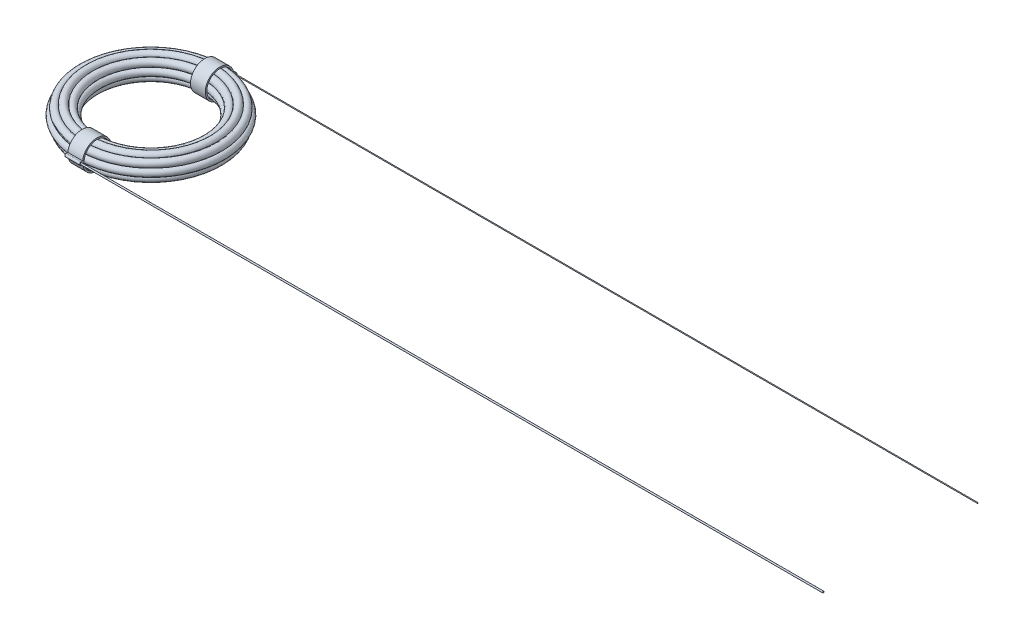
SolidWorks part; units mm, degrees
ref_plane "Alzado" through (0, 0, 0) normal (0, 0, 1) x (1, 0, 0)
ref_plane "Planta" through (0, 0, 0) normal (0, 1, 0) x (1, 0, 0)
ref_plane "Vista lateral" through (0, 0, 0) normal (1, 0, 0) x (0, 0, -1)
ref_plane "Plano1" through (0, 0, 0) normal (1, 0, 0) x (0, 0, -1)
sketch "Croquis1" plane through (0, 0, 0) normal (1, 0, 0) x (0, 0, -1)
  line L4 (-125, 0) -> (-125, -12.5) construction
  circle A121 centre (-125, 0) radius 25 construction
  circle A122 centre (-125, 0) radius 17.5 construction
  arc A123 (-143.0567, 7.4793) -> (-143.0567, -7.4793) centre (-142.5, 0) ccw
  arc A131 (-132.4793, 18.0567) -> (-143.0567, 7.4793) centre (-137.3744, 12.3744) ccw
  arc A132 (-117.5207, 18.0567) -> (-132.4793, 18.0567) centre (-125, 17.5) ccw
  arc A133 (-106.9433, 7.4793) -> (-117.5207, 18.0567) centre (-112.6256, 12.3744) ccw
  arc A134 (-106.9433, -7.4793) -> (-106.9433, 7.4793) centre (-107.5, 0) ccw
  arc A135 (-117.5207, -18.0567) -> (-106.9433, -7.4793) centre (-112.6256, -12.3744) ccw
  arc A136 (-132.4793, -18.0567) -> (-117.5207, -18.0567) centre (-125, -17.5) ccw
  arc A138 (-143.0567, -7.4793) -> (-132.4793, -18.0567) centre (-137.3744, -12.3744) ccw
  point P23 (-122.5, 0)
  point P34 (-500, 0)
  point P46 (-549.9834, 0)
  point P65 (-122.5, 0)
  dimension "D1" = 50
  dimension "D3" = 125
  dimension "D2" = 35
sketch "Croquis3" plane through (0, 0, 0) normal (1, 0, 0) x (0, 0, -1)
  line L0 (0, 26.5309) -> (0, -20.1402)
revolve "Revolución1" add sketch "Croquis1" angle 360 about L0
sketch "Croquis54" plane through (0, 0, 0) normal (0, 1, 0) x (1, 0, 0)
  circle A0 centre (0, 0) radius 150
  dimension "D1" = 300
ref_plane "Plano2" through (0, 59, 0) normal (0, 1, 0) x (1, 0, 0)
sketch "Croquis49" plane through (0, 0, 0) normal (1, 0, 0) x (0, 0, -1)
  line L3 (0, 0) -> (0, -155.9219) construction
  circle A95 centre (-500, 30) radius 7.5
  point P34 (-500, 0)
  point P46 (-549.9834, 0)
sketch "Croquis51" plane through (0, 0, 0) normal (1, 0, 0) x (0, 0, -1)
  line L3 (-124, 0) -> (-154.3993, 0) construction
  line L4 (-124, 0) -> (-124, -26.9591) construction
  line L5 (150, 0) -> (-150, 0) construction
  line L6 (-156, -3) -> (-152.8444, -3)
  line L7 (-156, 3) -> (-152.8444, 3)
  circle A22 centre (-124, 0) radius 30 construction
  circle A95 centre (-124, 0) radius 26
  arc A96 (-152.8444, -3) -> (-152.8444, 3) centre (-124, 0) ccw
  arc A97 (-156, 3) -> (-156, -3) centre (-156, 0) ccw
  point P34 (-113.4687, 0)
  point P46 (-172.9834, 0)
  dimension "D1" = 52
  dimension "D3" = 60
  dimension "D2" = 3
  dimension "D5" = 6
  dimension "D4" = 124
extrude "Saliente-Extruir1" add sketch "Croquis51" along normal mid plane 30 separate body
pattern_circular "MatrizC2" count 2 over 360 about axis through (0, 26.5309, 0) along (0, -1, 0)
ref_plane "Plano3" through (0, 50, 0) normal (0, 1, 0) x (1, 0, 0)
ref_plane "Plano4" through (0, 0, 153) normal (0, 0, 1) x (1, 0, 0)
sketch "Croquis55" plane through (15, 0, 0) normal (1, 0, 0) x (0, 0, -1)
  circle A0 centre (-156, 0) radius 1.5
  dimension "D1" = 3
extrude "Saliente-Extruir2" add sketch "Croquis55" along normal blind 1500 separate body
sketch "Croquis56" plane through (15, 0, 0) normal (1, 0, 0) x (0, 0, -1)
  circle A0 centre (156, 0) radius 0.75
  dimension "D1" = 1.5
extrude "Saliente-Extruir3" add sketch "Croquis56" along normal blind 1500 separate body
ref_plane "Plano5" through (-150, 0, 0) normal (1, 0, 0) x (0, 0, -1)
sketch "Croquis57" plane through (-150, 0, 0) normal (1, 0, 0) x (0, 0, -1)
  line L0 (150, 0) -> (-150, 0) construction
  line L1 (0, 26.5309) -> (0, -20.1402) construction
  ellipse E0 centre (0, 0) end of major axis (20, 0) minor radius 15
  dimension "D1" = 30
  dimension "D2" = 40
extrude "Cortar-Extruir2" cut sketch "Croquis57" along normal blind 10 draft 42
sketch "Croquis58" plane through (-140, 0, 0) normal (-1, 0, 0) x (0, 0, 1)
  circle A0 centre (0, 0) radius 5
extrude "Saliente-Extruir4" add sketch "Croquis58" along normal blind 1 separate body
